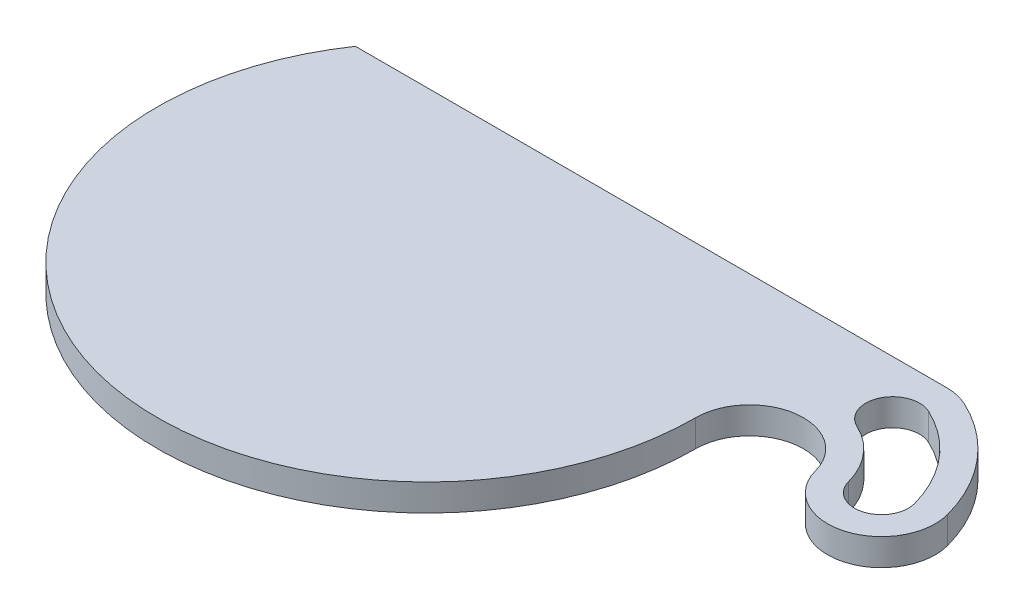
SolidWorks part; units mm, degrees
ref_plane "Front Plane" through (0, 0, 0) normal (0, 0, 1) x (1, 0, 0)
ref_plane "Top Plane" through (0, 0, 0) normal (0, 1, 0) x (1, 0, 0)
ref_plane "Right Plane" through (0, 0, 0) normal (1, 0, 0) x (0, 0, -1)
sketch "Sketch1" plane through (0, 0, 0) normal (0, 1, 0) x (1, 0, 0)
  line L1 (68.4524, 28.1262) -> (-41.3391, 28.1262)
  line L2 (60, 0) -> (79.3185, 5.1764) construction
  line L3 (60, 0) -> (68.4524, 18.1262) construction
  line L4 (60, -1000) -> (60, 49000) construction
  arc A0 (-41.3391, 28.1262) -> (50, 0) centre (0, 0) ccw
  arc A1 (50, 0) -> (69.6593, 2.5882) centre (60, 0) cw
  arc A5 (79.3185, 5.1764) -> (68.4524, 18.1262) centre (60, 0) ccw construction
  arc A10 (79.3185, 5.1764) -> (68.4524, 18.1262) centre (60, 0) ccw construction
  arc A11 (84.1481, 6.4705) -> (70.5655, 22.6577) centre (60, 0) ccw
  arc A12 (74.4889, 3.8823) -> (66.3393, 13.5946) centre (60, 0) ccw
  arc A13 (74.4889, 3.8823) -> (84.1481, 6.4705) centre (79.3185, 5.1764) ccw
  arc A14 (70.5655, 22.6577) -> (66.3393, 13.5946) centre (68.4524, 18.1262) ccw
  arc A15 (88.9778, 7.7646) -> (72.6785, 27.1892) centre (60, 0) ccw
  arc A16 (69.6593, 2.5882) -> (64.2262, 9.0631) centre (60, 0) ccw
  arc A17 (69.6593, 2.5882) -> (88.9778, 7.7646) centre (79.3185, 5.1764) ccw
  arc A18 (72.6785, 27.1892) -> (64.2262, 9.0631) centre (68.4524, 18.1262) ccw
  point P8 (75.3209, 12.8558)
  point P16 (41.3391, 28.1262)
  point P20 (75.3209, 12.8558)
  dimension "D1" = 100
  dimension "D2" = 10
  dimension "D3" = 5
  dimension "D5" = 105
  dimension "D6" = 5
  dimension "D8" = 5
  dimension "D4" = 25
extrude "Boss-Extrude2" add sketch "Sketch1" along normal blind 5
